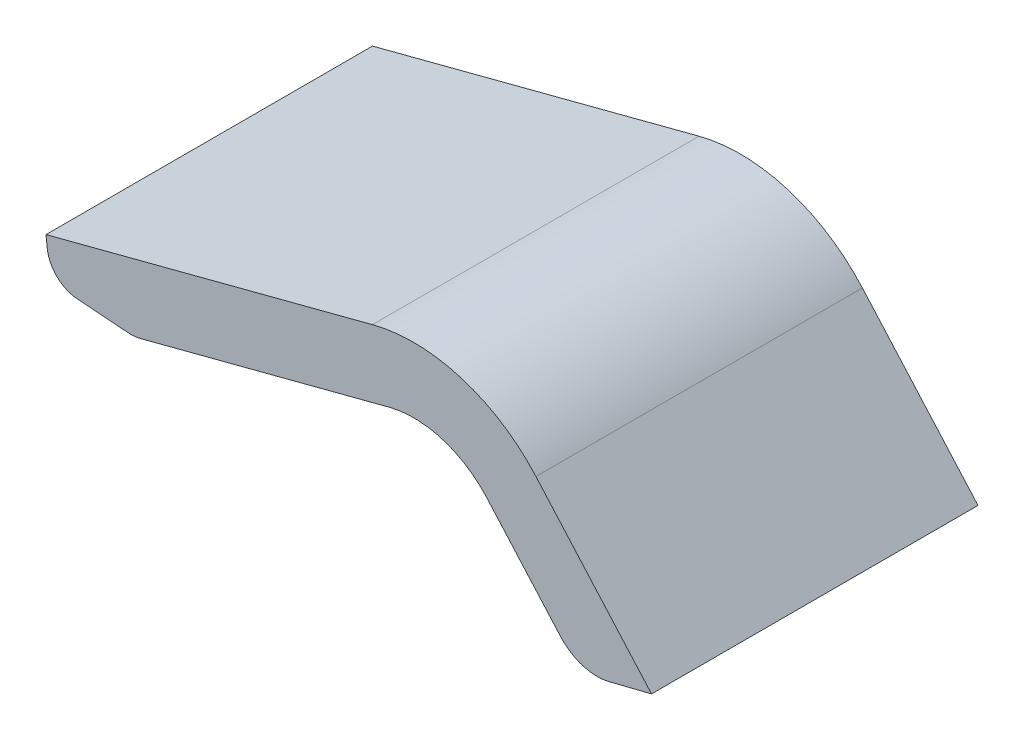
SolidWorks part; units mm, degrees
ref_plane "Plan de face" through (0, 0, 0) normal (0, 0, 1) x (1, 0, 0)
ref_plane "Plan de dessus" through (0, 0, 0) normal (0, 1, 0) x (1, 0, 0)
ref_plane "Plan de droite" through (0, 0, 0) normal (1, 0, 0) x (0, 0, -1)
sketch "Esquisse1" plane through (0, 0, 0) normal (0, 0, 1) x (1, 0, 0)
  line L0 (-14.5773, -1.8236) -> (2.4328, 2.6158) construction
  line L1 (-18.5773, 1.2664) -> (1.4227, 6.4862)
  line L2 (11.4347, 3.4397) -> (18.516, -4.5572)
  line L3 (18.516, -4.5572) -> (15.9036, -5.2078)
  line L4 (-18.5773, 1.2664) -> (-18.5023, 0.5859)
  line L5 (-16.6631, -1.1896) -> (-13.4835, -1.4268)
  line L6 (-12.8297, -1.3675) -> (2.4328, 2.6158)
  line L7 (8.44, 0.788) -> (12.9327, -4.2856)
  line L8 (10.8506, -1.9343) -> (10.8506, -1.9343)
  line L9 (18.516, -5.6474) -> (12.338, -5.6474) construction
  line L10 (8.44, 0.788) -> (10.8506, -1.9343) construction
  line L11 (10.8506, -1.9343) -> (10.8506, -1.9343) construction
  line L13 (-14.5773, -4.5418) -> (-14.5773, -1.8236) construction
  line L14 (-18.5773, -4.5418) -> (-18.5773, 1.2664) construction
  line L15 (18.516, -4.5572) -> (18.516, -5.6474) construction
  arc A0 (11.4347, 3.4397) -> (1.4227, 6.4862) centre (3.948, -3.1897) ccw
  arc A1 (8.44, 0.788) -> (2.4328, 2.6158) centre (3.948, -3.1897) ccw
  arc A2 (-16.6631, -1.1896) -> (-18.5023, 0.5859) centre (-16.5143, 0.8049) cw
  arc A3 (15.9036, -5.2078) -> (12.9327, -4.2856) centre (15.1787, -2.2967) cw
  arc A4 (-12.8297, -1.3675) -> (-13.4835, -1.4268) centre (-13.3347, 0.5677) cw
  dimension "D2" = 2
  dimension "D3" = 3
  dimension "D1" = 4
extrude "Extrusion1" add sketch "Esquisse1" along normal blind 20
ref_plane "Plan milieu" through (0, 0, 10) normal (0, 0, 1) x (1, 0, 0)
